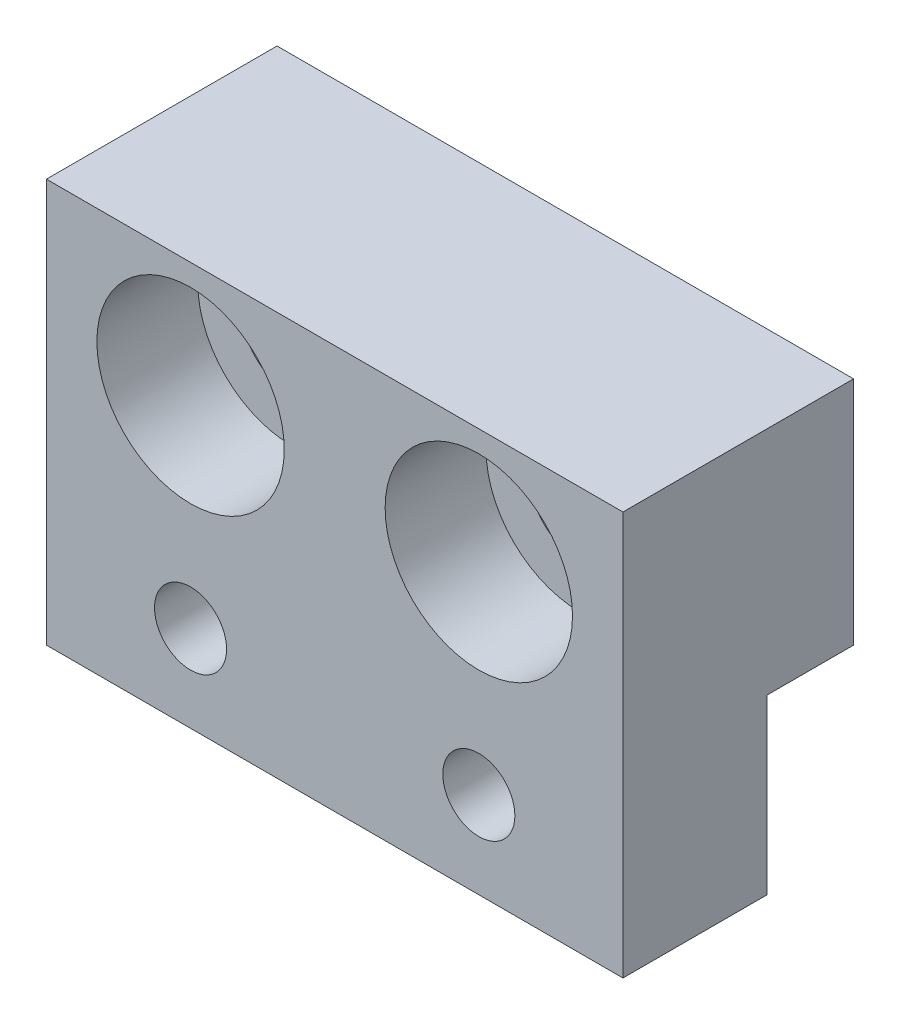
SolidWorks part; units mm, degrees
ref_plane "前视基准面" through (0, 0, 0) normal (0, 0, 1) x (1, 0, 0)
ref_plane "上视基准面" through (0, 0, 0) normal (0, 1, 0) x (1, 0, 0)
ref_plane "右视基准面" through (0, 0, 0) normal (1, 0, 0) x (0, 0, -1)
sketch "草图1" plane through (0, 0, 0) normal (0, 0, 1) x (1, 0, 0)
  line L0 (0, 14) -> (20, 14)
  line L1 (0, 0) -> (20, 0)
  line L2 (0, 0) -> (0, 14)
  line L3 (20, 0) -> (20, 14)
  circle A0 centre (15, 10) radius 1.75
  circle A1 centre (5, 10) radius 1.75
  circle A2 centre (5, 3) radius 1.25
  circle A3 centre (15, 3) radius 1.25
extrude "凸台-拉伸1" add sketch "草图1" along normal blind 8
sketch "草图2" plane through (0, 0, 8) normal (0, 0, 1) x (1, 0, 0)
  circle A0 centre (15, 10) radius 3.25
  circle A1 centre (5, 10) radius 3.25
extrude "切除-拉伸1" cut sketch "草图2" against normal blind 3.5
sketch "草图4" plane through (20, 0, 0) normal (1, 0, 0) x (0, 0, -1)
  line L0 (-8, 14) -> (0, 14)
  line L1 (-3, 6) -> (0, 6)
  line L2 (0, 6) -> (0, 14)
  line L3 (-3, 0) -> (-3, 6)
  line L4 (-8, 0) -> (-8, 14)
  line L5 (-8, 0) -> (-3, 0)
extrude "切除-拉伸2" cut sketch "草图4" against normal through all flip side to cut
